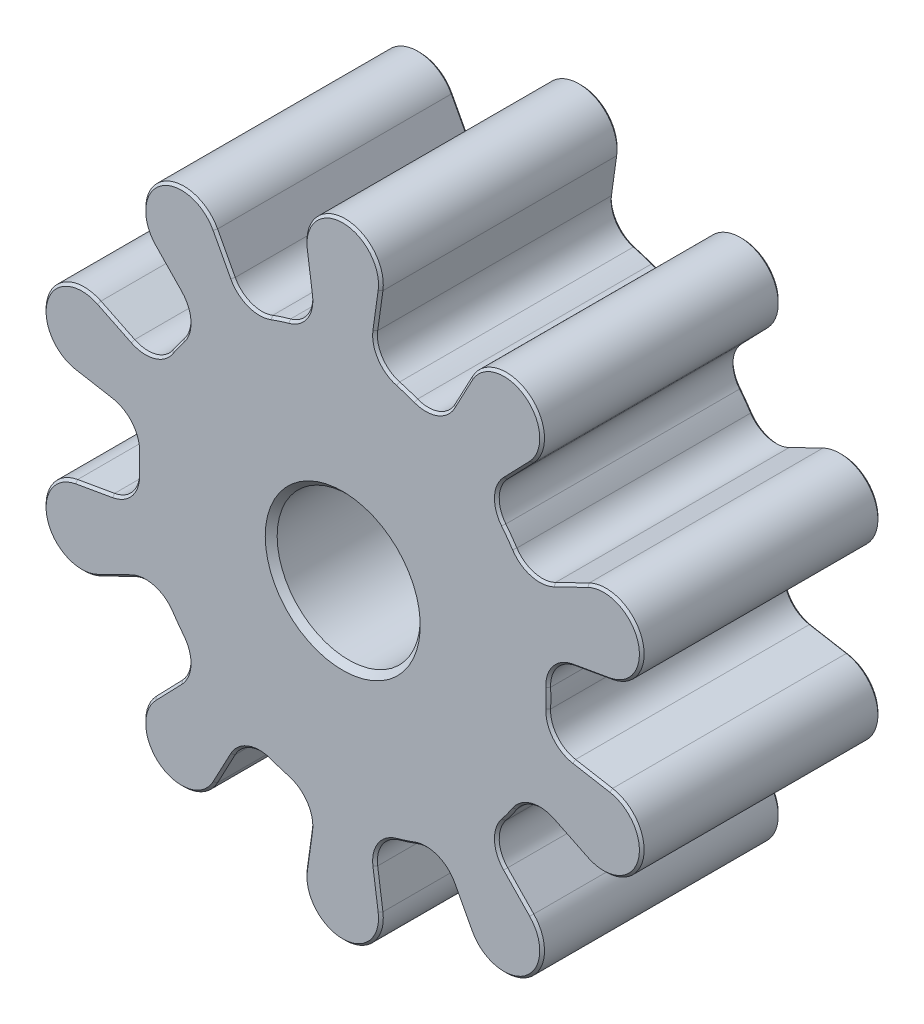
SolidWorks part; units mm, degrees
ref_plane "Спереди" through (0, 0, 0) normal (0, 0, 1) x (1, 0, 0)
ref_plane "Сверху" through (0, 0, 0) normal (0, 1, 0) x (1, 0, 0)
ref_plane "Справа" through (0, 0, 0) normal (1, 0, 0) x (0, 0, -1)
sketch "Эскиз1" plane through (0, 0, 0) normal (0, 0, 1) x (1, 0, 0)
  line L0 (-1.3653, 9.7177) -> (-1.5844, 11.2774)
  line L1 (1.3653, 9.7177) -> (1.5844, 11.2774)
  line L2 (4.6074, 8.6643) -> (5.3468, 10.0549)
  line L3 (6.8165, 7.0593) -> (7.9105, 8.1923)
  line L4 (8.8202, 4.3014) -> (10.2358, 4.9918)
  line L5 (9.664, 1.7045) -> (11.2151, 1.978)
  line L6 (9.664, -1.7045) -> (11.2151, -1.978)
  line L7 (8.8202, -4.3014) -> (10.2358, -4.9918)
  line L8 (6.8165, -7.0593) -> (7.9105, -8.1923)
  line L9 (4.6074, -8.6643) -> (5.3468, -10.0549)
  line L10 (1.3653, -9.7177) -> (1.5844, -11.2774)
  line L11 (-1.3653, -9.7177) -> (-1.5844, -11.2774)
  line L12 (-4.6074, -8.6643) -> (-5.3468, -10.0549)
  line L13 (-6.8165, -7.0593) -> (-7.9105, -8.1923)
  line L14 (-8.8202, -4.3014) -> (-10.2358, -4.9918)
  line L15 (-9.664, -1.7045) -> (-11.2151, -1.978)
  line L16 (-9.664, 1.7045) -> (-11.2151, 1.978)
  line L17 (-8.8202, 4.3014) -> (-10.2358, 4.9918)
  line L18 (-6.8165, 7.0593) -> (-7.9105, 8.1923)
  line L19 (-4.6074, 8.6643) -> (-5.3468, 10.0549)
  line L20 (0, 0) -> (0, -13.1) construction
  line L32 (-0.3625, 2.5803) -> (-1.5844, 11.2774)
  line L33 (0.373, 2.6547) -> (1.5844, 11.2774)
  line L34 (5.4486, 1.5554) -> (9.5721, 9.3097)
  line L35 (6.0874, 1.1833) -> (12.1358, 7.4471)
  line L36 (9.5475, -2.6895) -> (17.4414, 1.1601)
  line L37 (9.8456, -3.366) -> (18.4206, -1.8536)
  line L38 (10.3685, -8.533) -> (19.0176, -10.0584)
  line L39 (10.212, -9.2555) -> (18.0383, -13.0722)
  line L40 (7.598, -13.743) -> (13.6986, -20.0609)
  line L41 (7.0467, -14.2355) -> (11.1349, -21.9235)
  line L42 (2.2943, -16.3295) -> (3.5162, -25.0267)
  line L43 (1.5587, -16.404) -> (0.3473, -25.0267)
  line L44 (-4.1557, -14.9325) -> (-10.2041, -21.1963)
  line L45 (-7.6158, -11.0597) -> (-15.5096, -14.9094)
  line L46 (-7.9139, -10.3832) -> (-16.4889, -11.8956)
  line L47 (-8.4368, -5.2163) -> (-17.0858, -3.6908)
  line L48 (-8.2803, -4.4938) -> (-16.1066, -0.677)
  line L49 (-5.6663, -0.0063) -> (-11.7669, 6.3116)
  line L50 (-5.115, 0.4863) -> (-9.2032, 8.1743)
  line L51 (9.5475, -2.6895) -> (17.4414, 1.1601)
  line L52 (9.8456, -3.366) -> (18.4206, -1.8536)
  line L53 (10.3685, -8.533) -> (19.0176, -10.0584)
  line L54 (10.212, -9.2555) -> (18.0383, -13.0722)
  line L55 (7.598, -13.743) -> (13.6986, -20.0609)
  line L56 (7.0467, -14.2355) -> (11.1349, -21.9235)
  line L57 (2.2943, -16.3295) -> (3.5162, -25.0267)
  line L58 (1.5587, -16.404) -> (0.3473, -25.0267)
  line L59 (-3.5169, -15.3046) -> (-7.6404, -23.059)
  line L60 (5.4486, 1.5554) -> (9.5721, 9.3097)
  line L61 (6.0874, 1.1833) -> (12.1358, 7.4471)
  circle A0 centre (0, 0) radius 11.5 construction
  arc A1 (1.5844, 11.2774) -> (-1.5844, 11.2774) centre (0, 11.5) ccw
  circle A2 centre (0, 0) radius 3
  arc A3 (-8.6159, 0.3955) -> (-8.6159, -0.3955) centre (0, 0) ccw
  arc A4 (7.9105, 8.1923) -> (5.3468, 10.0549) centre (6.7595, 9.3037) ccw
  arc A5 (11.2151, 1.978) -> (10.2358, 4.9918) centre (10.9371, 3.5537) ccw
  arc A6 (10.2358, -4.9918) -> (11.2151, -1.978) centre (10.9371, -3.5537) ccw
  arc A7 (5.3468, -10.0549) -> (7.9105, -8.1923) centre (6.7595, -9.3037) ccw
  arc A8 (-1.5844, -11.2774) -> (1.5844, -11.2774) centre (0, -11.5) ccw
  arc A9 (-7.9105, -8.1923) -> (-5.3468, -10.0549) centre (-6.7595, -9.3037) ccw
  arc A10 (-11.2151, -1.978) -> (-10.2358, -4.9918) centre (-10.9371, -3.5537) ccw
  arc A11 (-10.2358, 4.9918) -> (-11.2151, 1.978) centre (-10.9371, 3.5537) ccw
  arc A12 (-5.3468, 10.0549) -> (-7.9105, 8.1923) centre (-6.7595, 9.3037) ccw
  arc A13 (-6.738, 5.3843) -> (-7.2029, 4.7443) centre (0, 0) ccw
  arc A14 (-2.2863, 8.3165) -> (-3.0386, 8.072) centre (0, 0) ccw
  arc A15 (3.0386, 8.072) -> (2.2863, 8.3165) centre (0, 0) ccw
  arc A16 (7.2029, 4.7443) -> (6.738, 5.3843) centre (0, 0) ccw
  arc A17 (8.6159, -0.3955) -> (8.6159, 0.3955) centre (0, 0) ccw
  arc A18 (6.738, -5.3843) -> (7.2029, -4.7443) centre (0, 0) ccw
  arc A19 (2.2863, -8.3165) -> (3.0386, -8.072) centre (0, 0) ccw
  arc A20 (-3.0386, -8.072) -> (-2.2863, -8.3165) centre (0, 0) ccw
  arc A21 (-7.2029, -4.7443) -> (-6.738, -5.3843) centre (0, 0) ccw
  arc A22 (-6.8165, 7.0593) -> (-6.738, 5.3843) centre (-7.7301, 6.1771) cw
  arc A23 (-8.8202, 4.3014) -> (-7.2029, 4.7443) centre (-8.2635, 5.4429) ccw
  arc A24 (-9.664, 1.7045) -> (-8.6159, 0.3955) centre (-9.8846, 0.4538) cw
  arc A25 (-9.664, -1.7045) -> (-8.6159, -0.3955) centre (-9.8846, -0.4538) ccw
  arc A26 (-8.8202, -4.3014) -> (-7.2029, -4.7443) centre (-8.2635, -5.4429) cw
  arc A27 (-6.8165, -7.0593) -> (-6.738, -5.3843) centre (-7.7301, -6.1771) ccw
  arc A28 (-4.6074, -8.6643) -> (-3.0386, -8.072) centre (-3.4861, -9.2606) cw
  arc A29 (-1.3653, -9.7177) -> (-2.2863, -8.3165) centre (-2.623, -9.541) ccw
  arc A30 (1.3653, -9.7177) -> (2.2863, -8.3165) centre (2.623, -9.541) cw
  arc A31 (4.6074, -8.6643) -> (3.0386, -8.072) centre (3.4861, -9.2606) ccw
  arc A32 (6.8165, -7.0593) -> (6.738, -5.3843) centre (7.7301, -6.1771) cw
  arc A33 (8.8202, -4.3014) -> (7.2029, -4.7443) centre (8.2635, -5.4429) ccw
  arc A34 (9.664, -1.7045) -> (8.6159, -0.3955) centre (9.8846, -0.4538) cw
  arc A35 (9.664, 1.7045) -> (8.6159, 0.3955) centre (9.8846, 0.4538) ccw
  arc A36 (8.8202, 4.3014) -> (7.2029, 4.7443) centre (8.2635, 5.4429) cw
  arc A37 (6.8165, 7.0593) -> (6.738, 5.3843) centre (7.7301, 6.1771) ccw
  arc A38 (4.6074, 8.6643) -> (3.0386, 8.072) centre (3.4861, 9.2606) cw
  arc A39 (1.3653, 9.7177) -> (2.2863, 8.3165) centre (2.623, 9.541) ccw
  arc A40 (-1.3653, 9.7177) -> (-2.2863, 8.3165) centre (-2.623, 9.541) cw
  arc A41 (-4.6074, 8.6643) -> (-3.0386, 8.072) centre (-3.4861, 9.2606) ccw
  arc A66 (1.5844, 11.2774) -> (-1.5844, 11.2774) centre (0, 11.5) ccw
  arc A67 (12.1358, 7.4471) -> (9.5721, 9.3097) centre (10.9848, 8.5585) ccw
  arc A68 (18.4206, -1.8536) -> (17.4414, 1.1601) centre (18.1427, -0.278) ccw
  arc A69 (18.0383, -13.0722) -> (19.0176, -10.0584) centre (18.7396, -11.6341) ccw
  arc A70 (11.1349, -21.9235) -> (13.6986, -20.0609) centre (12.5476, -21.1723) ccw
  arc A71 (0.3473, -25.0267) -> (3.5162, -25.0267) centre (1.9317, -25.2493) ccw
  arc A72 (-10.2041, -21.1963) -> (-7.6404, -23.059) centre (-9.0531, -22.3077) ccw
  arc A73 (-16.4889, -11.8956) -> (-15.5096, -14.9094) centre (-16.211, -13.4713) ccw
  arc A74 (-16.1066, -0.677) -> (-17.0858, -3.6908) centre (-16.8079, -2.1152) ccw
  arc A75 (-9.2032, 8.1743) -> (-11.7669, 6.3116) centre (-10.6159, 7.423) ccw
  arc A76 (18.4206, -1.8536) -> (17.4414, 1.1601) centre (18.1427, -0.278) ccw
  arc A77 (18.0383, -13.0722) -> (19.0176, -10.0584) centre (18.7396, -11.6341) ccw
  arc A78 (11.1349, -21.9235) -> (13.6986, -20.0609) centre (12.5476, -21.1723) ccw
  arc A79 (0.3473, -25.0267) -> (3.5162, -25.0267) centre (1.9317, -25.2493) ccw
  arc A80 (12.1358, 7.4471) -> (9.5721, 9.3097) centre (10.9848, 8.5585) ccw
  point P56 (-5.9912, 6.2046)
  point P65 (-7.7523, -3.7806)
  point P70 (-4.0495, -7.6152)
  point P75 (1.2, -8.5411)
  point P80 (5.9912, -6.2046)
  point P85 (8.4939, -1.4981)
  point P90 (7.7523, 3.7806)
  point P95 (4.0495, 7.6152)
  point P100 (-1.2, 8.5411)
  dimension "D1" = 23
  dimension "D2" = 3.2
  dimension "D3" = 6
  dimension "D5" = 17.25
  dimension "D6" = 10
  dimension "D7" = 1.27
  dimension "D4" = 10
extrude "Бобышка-Вытянуть1" add sketch "Эскиз1" along normal blind 10
chamfer "Фаска1" distance 0.25 angle 45 2 edges at (3, 0, 0) (3, 0, 10)
chamfer "Фаска2" distance 0.1 angle 45 120 edges at (7.7, -10.5981, 0) (7.3635, -7.6258, 0) (4.9771, -9.3596, 0) (6.4615, -6.2366, 0) (3.9346, -8.0725, 0) (6.9778, -5.0696, 0) (2.6653, -8.2029, 0) (7.9281, -4.218, 0) (1.5617, -8.8435, 0) (9.528, -4.6466, 0) (1.4749, -10.4976, 0) (12.4588, -4.0481, 0) (0, -13.1, 0) (10.4395, -1.8412, 0) (-1.4749, -10.4976, 0) (8.8932, -1.2475, 0) (-1.5617, -8.8435, 0) (8.625, 0, 0) (-2.6653, -8.2029, 0) (8.8932, 1.2475, 0) (-3.9346, -8.0725, 0) (10.4395, 1.8412, 0) (-4.9771, -9.3596, 0) (12.4588, 4.0481, 0) (-7.7, -10.5981, 0) (9.528, 4.6466, 0) (-7.3635, -7.6258, 0) (7.9281, 4.218, 0) (-6.4615, -6.2366, 0) (6.9778, 5.0696, 0) (-6.9778, -5.0696, 0) (6.4615, 6.2366, 0) (-7.9281, -4.218, 0) (7.3635, 7.6258, 0) (-9.528, -4.6466, 0) (7.7, 10.5981, 0) (-12.4588, -4.0481, 0) (4.9771, 9.3596, 0) (-10.4395, -1.8412, 0) (3.9346, 8.0725, 0) (-8.8932, -1.2475, 0) (2.6653, 8.2029, 0) (-8.625, 0, 0) (1.5617, 8.8435, 0) (-8.8932, 1.2475, 0) (1.4749, 10.4976, 0) (-10.4395, 1.8412, 0) (0, 13.1, 0) (-12.4588, 4.0481, 0) (-1.4749, 10.4976, 0) (-9.528, 4.6466, 0) (-1.5617, 8.8435, 0) (-7.9281, 4.218, 0) (-2.6653, 8.2029, 0) (-6.9778, 5.0696, 0) (-3.9346, 8.0725, 0) (-6.4615, 6.2366, 0) (-4.9771, 9.3596, 0) (-7.3635, 7.6258, 0) (-7.7, 10.5981, 0) (7.7, -10.5981, 10) (7.3635, -7.6258, 10) (4.9771, -9.3596, 10) (6.4615, -6.2366, 10) (3.9346, -8.0725, 10) (6.9778, -5.0696, 10) (2.6653, -8.2029, 10) (7.9281, -4.218, 10) (1.5617, -8.8435, 10) (9.528, -4.6466, 10) (1.4749, -10.4976, 10) (12.4588, -4.0481, 10) (0, -13.1, 10) (10.4395, -1.8412, 10) (-1.4749, -10.4976, 10) (8.8932, -1.2475, 10) (-1.5617, -8.8435, 10) (8.625, 0, 10) (-2.6653, -8.2029, 10) (8.8932, 1.2475, 10) (-3.9346, -8.0725, 10) (10.4395, 1.8412, 10) (-4.9771, -9.3596, 10) (12.4588, 4.0481, 10) (-7.7, -10.5981, 10) (9.528, 4.6466, 10) (-7.3635, -7.6258, 10) (7.9281, 4.218, 10) (-6.4615, -6.2366, 10) (6.9778, 5.0696, 10) (-6.9778, -5.0696, 10) (6.4615, 6.2366, 10) (-7.9281, -4.218, 10) (7.3635, 7.6258, 10) (-9.528, -4.6466, 10) (7.7, 10.5981, 10) (-12.4588, -4.0481, 10) (4.9771, 9.3596, 10) (-10.4395, -1.8412, 10) (3.9346, 8.0725, 10) (-8.8932, -1.2475, 10) (2.6653, 8.2029, 10) (-8.625, 0, 10) (1.5617, 8.8435, 10) (-8.8932, 1.2475, 10) (1.4749, 10.4976, 10) (-10.4395, 1.8412, 10) (0, 13.1, 10) (-12.4588, 4.0481, 10) (-1.4749, 10.4976, 10) (-9.528, 4.6466, 10) (-1.5617, 8.8435, 10) (-7.9281, 4.218, 10) (-2.6653, 8.2029, 10) (-6.9778, 5.0696, 10) (-3.9346, 8.0725, 10) (-6.4615, 6.2366, 10) (-4.9771, 9.3596, 10) (-7.3635, 7.6258, 10) (-7.7, 10.5981, 10)
